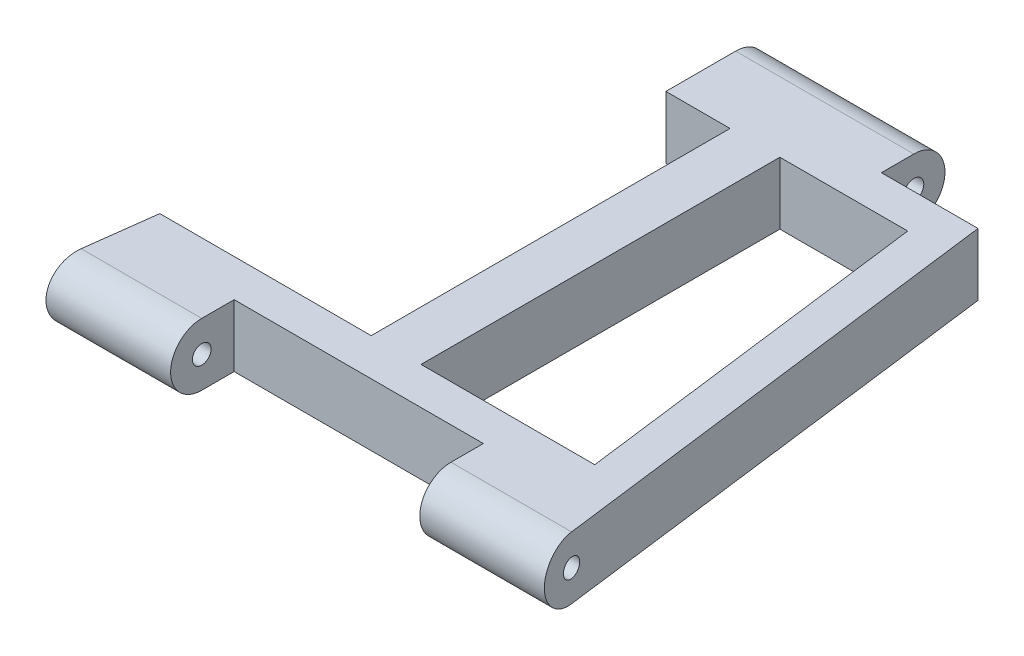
SolidWorks part; units mm, degrees
ref_plane "Спереди" through (0, 0, 0) normal (0, 0, 1) x (1, 0, 0)
ref_plane "Сверху" through (0, 0, 0) normal (0, 1, 0) x (1, 0, 0)
ref_plane "Справа" through (0, 0, 0) normal (1, 0, 0) x (0, 0, -1)
sketch "Эскиз1" plane through (0, 0, 0) normal (0, 1, 0) x (1, 0, 0)
  line L0 (-121.5375, 96.1191) -> (-69.7342, 96.1191)
  line L1 (-128.0375, 106.3191) -> (-71.0375, 106.3191)
  line L3 (-128.0375, 16.3191) -> (-71.0375, 16.3191)
  line L4 (-71.0375, 106.3191) -> (-71.0375, 16.3191)
  line L5 (-113.8375, 106.3191) -> (-85.2375, 106.3191)
  line L6 (-113.8375, 106.3191) -> (-113.8375, 96.1191)
  line L7 (-113.8375, 96.1191) -> (-85.2375, 96.1191)
  line L8 (-85.2375, 106.3191) -> (-85.2375, 96.1191)
  line L9 (-99.5375, 114.6654) -> (-99.5375, 17.4292) construction
  line L10 (-139.5375, 16.3191) -> (-59.5375, 16.3191)
  line L11 (-137.4675, 32.5191) -> (-139.5375, 16.3191)
  line L12 (-119.5375, 26.5191) -> (-119.5375, 16.3191)
  line L13 (-99.5375, 47.3774) -> (-99.5375, 23.4299)
  line L14 (-119.5375, 26.5191) -> (-79.5375, 26.5191)
  line L15 (-61.6075, 32.5191) -> (-137.4675, 32.5191)
  line L16 (-103.5375, 96.1191) -> (-103.5375, 32.5191)
  line L17 (-130.1075, 90.1191) -> (-71.0375, 90.1191)
  line L18 (-121.5375, 96.1191) -> (-121.5375, 32.5191)
  line L19 (-95.5375, 96.1191) -> (-95.5375, 32.5191)
  line L20 (-77.5375, 96.1191) -> (-129.3409, 96.1191)
  line L21 (-68.9675, 90.1191) -> (-128.0375, 90.1191)
  line L22 (-79.5375, 26.5191) -> (-79.5375, 16.3191)
  line L23 (-75.8413, 96.576) -> (-65.5973, 16.4055)
  line L24 (-71.0375, 106.3191) -> (-59.5375, 16.3191)
  line L25 (-129.5375, 32.5191) -> (-129.5375, 96.1191)
  line L26 (-121.5375, 96.1191) -> (-129.5375, 96.1191)
  line L27 (-113.8375, 96.1191) -> (-113.8375, 90.1191)
  point P14 (-99.5375, 16.3191)
  point P15 (-99.5375, 16.3191)
  point P41 (-99.5375, 26.5191)
  point P42 (-99.5375, 32.5191)
  dimension "D2" = 90
  dimension "D3" = 10.2
  dimension "D4" = 28.6
  dimension "D5" = 16.2
  dimension "D6" = 14.2
  dimension "D7" = 30
  dimension "D8" = 8
  dimension "D10" = 20
  dimension "D11" = 20
  dimension "D12" = 10.2
  dimension "D13" = 4
  dimension "D14" = 6
  dimension "D15" = 6
extrude "Бобышка-Вытянуть1" add sketch "Эскиз1" along normal blind 10
sketch "Эскиз2" plane through (-113.8375, 0, 0) normal (-1, 0, 0) x (0, 0, 1)
  line L4 (-106.3191, 0) -> (-90.1191, 0)
  line L5 (-90.1191, 0) -> (-90.1191, 10)
  line L6 (-90.1191, 10) -> (-106.3191, 10)
  line L7 (-106.3191, 10) -> (-106.3191, 0)
  line L8 (-106.3191, 0) -> (-90.1191, 0)
  line L10 (-90.1191, 10) -> (-106.3191, 10)
  line L11 (-106.3191, 10) -> (-106.3191, 0)
  line L12 (-90.1191, 0) -> (-90.1191, 10)
  circle A0 centre (-101.3191, 5) radius 5
  circle A1 centre (-101.3191, 5) radius 1.6
  dimension "D2" = 3.2
  dimension "D1" = 0
extrude "Вырез-Вытянуть1" cut sketch "Эскиз2" against normal up to surface (28.6 mm away) contours A1 | A0 L10 M10 | A0 L11 M7
sketch "Эскиз3" plane through (-79.5375, 0, 0) normal (-1, 0, 0) x (0, 0, 1)
  line L4 (-26.5191, 0) -> (-16.3191, 0)
  line L5 (-16.3191, 0) -> (-16.3191, 10)
  line L6 (-16.3191, 10) -> (-26.5191, 10)
  line L7 (-26.5191, 10) -> (-26.5191, 0)
  line L8 (-26.5191, 0) -> (-16.3191, 0)
  line L9 (-16.3191, 0) -> (-16.3191, 10)
  line L10 (-16.3191, 10) -> (-26.5191, 10)
  line L11 (-26.5191, 10) -> (-26.5191, 0)
  circle A0 centre (-21.3191, 5) radius 5
  circle A1 centre (-21.3191, 5) radius 1.5
  dimension "D2" = 10
  dimension "D3" = 3
  dimension "D1" = 0
extrude "Вырез-Вытянуть2" cut sketch "Эскиз3" against normal through all both and the other way through all contours A1 | A0 L9 M8 | A0 L8 M7
